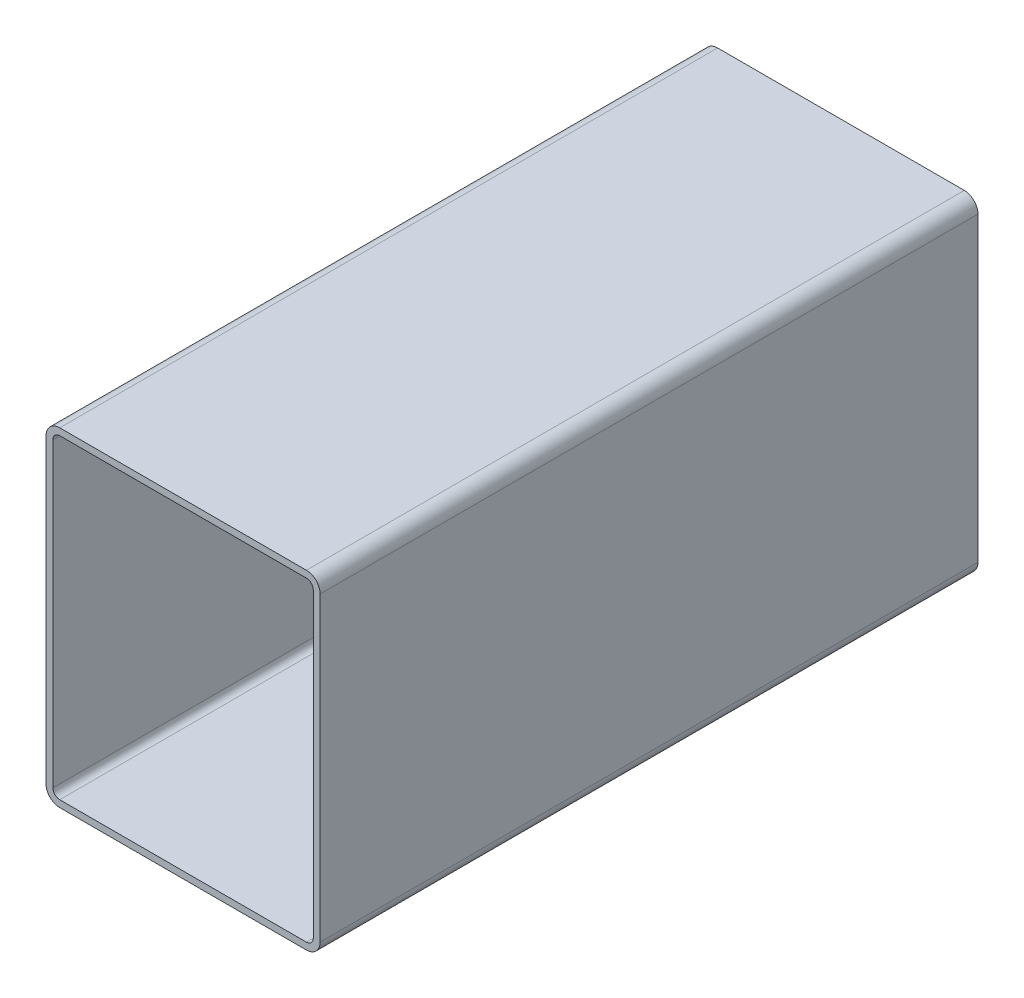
SolidWorks part; units mm, degrees
ref_plane "Front Plane" through (0, 0, 0) normal (0, 0, 1) x (1, 0, 0)
ref_plane "Top Plane" through (0, 0, 0) normal (0, 1, 0) x (1, 0, 0)
ref_plane "Right Plane" through (0, 0, 0) normal (1, 0, 0) x (0, 0, -1)
sketch "Sketch1" plane through (0, 0, 0) normal (0, 0, 1) x (1, 0, 0)
sketch_block_instance "HSS6x5x0.125-1"
sketch_block "HSS6x5x0.125"
extrude "Boss-Extrude1" add sketch "Sketch1" along normal blind 304.8
